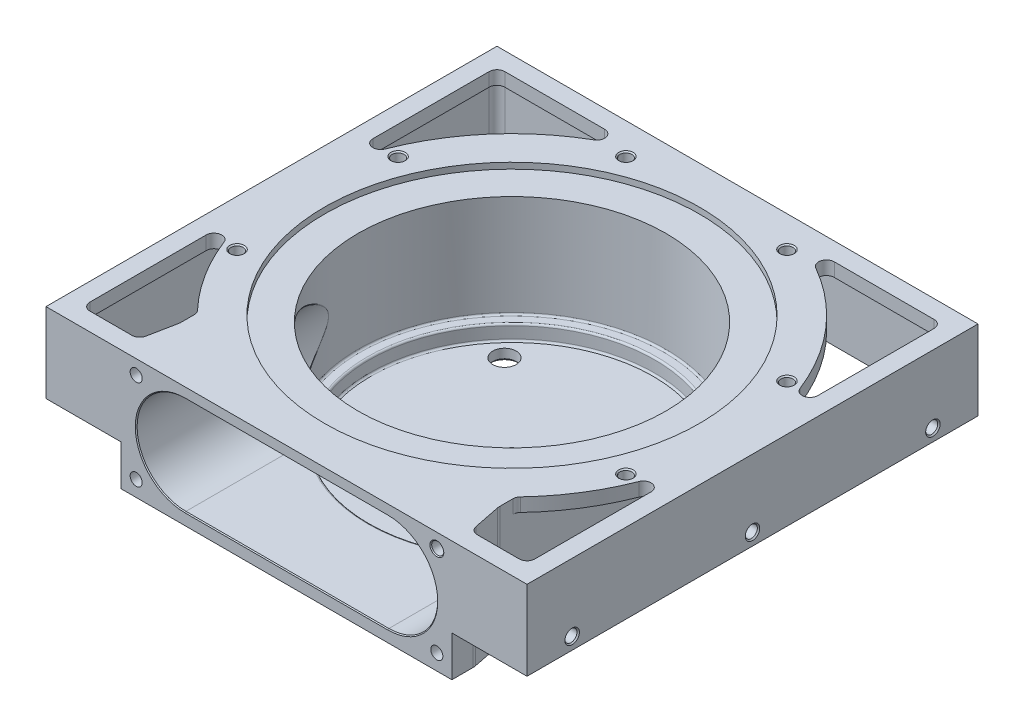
SolidWorks part; units mm, degrees
ref_plane "Front Plane" through (0, 0, 0) normal (0, 0, 1) x (1, 0, 0)
ref_plane "Top Plane" through (0, 0, 0) normal (0, 1, 0) x (1, 0, 0)
ref_plane "Right Plane" through (0, 0, 0) normal (1, 0, 0) x (0, 0, -1)
sketch "Sketch1" plane through (0, 0, 0) normal (0, 1, 0) x (1, 0, 0)
  line L1 (0, 0) -> (203.2, 0)
  line L2 (0, 0) -> (0, 190.5)
  line L3 (0, 190.5) -> (203.2, 190.5)
  line L4 (203.2, 0) -> (203.2, 190.5)
  dimension "D1" = 203.2
  dimension "D2" = 190.5
extrude "block" add sketch "Sketch1" along normal blind 57.15
sketch "Sketch2" plane through (0, 57.15, 0) normal (0, 1, 0) x (1, 0, 0)
  line L0 (101.6, 190.5) -> (101.6, 23.7633) construction
  line L1 (203.2, 190.5) -> (0, 190.5) construction
  line L2 (0, 0) -> (203.2, 0) construction
  circle A0 centre (101.6, 95.25) radius 79.1845
  dimension "D1" = 158.369
  dimension "D2" = 95.25
extrude "tube c bore" cut sketch "Sketch2" against normal blind 2.54
sketch "Sketch9" plane through (0, 54.61, 0) normal (0, 1, 0) x (1, 0, 0)
  line L0 (101.6, 0) -> (101.6, 75.3419) construction
  line L1 (0, 0) -> (203.2, 0) construction
  circle A0 centre (101.6, 95.25) radius 65.024
  dimension "D1" = 130.048
extrude "tube ID cbore" cut sketch "Sketch9" against normal blind 43.18
sketch "Sketch33" plane through (0, 11.43, 0) normal (0, 1, 0) x (1, 0, 0)
  circle A0 centre (101.6, 95.25) radius 60.325
  dimension "D1" = 120.65
extrude "bottom of chamber" cut sketch "Sketch33" against normal blind 6.35
sketch "Sketch5" plane through (0, 0, 0) normal (0, 0, 1) x (1, 0, 0)
  line L0 (101.6, 57.15) -> (101.6, 0) construction
  line L1 (0, 57.15) -> (203.2, 57.15) construction
  line L2 (0, 0) -> (203.2, 0) construction
  line L3 (1.5875, 32.0675) -> (243.4251, 32.0675) construction
  line L4 (58.7375, 52.705) -> (144.4625, 52.705)
  line L5 (144.4625, 11.43) -> (58.7375, 11.43)
  line L10 (166.624, 11.43) -> (36.576, 11.43) construction
  line L11 (101.6, 52.705) -> (101.6, 63.6582) construction
  arc A1 (58.7375, 52.705) -> (58.7375, 11.43) centre (58.7375, 32.0675) ccw
  arc A2 (144.4625, 11.43) -> (144.4625, 52.705) centre (144.4625, 32.0675) ccw
  dimension "D2" = 41.275
  dimension "D4" = 41.275
  dimension "D6" = 85.725
extrude "sensor port" cut sketch "Sketch5" against normal blind 101.6
sketch "Sketch11" plane through (0, 57.15, 0) normal (0, 1, 0) x (1, 0, 0)
  line L0 (101.6, 190.5) -> (101.6, 95.25) construction
  line L1 (101.6, 95.25) -> (101.6, 74.9411) construction
  line L2 (203.2, 190.5) -> (0, 190.5) construction
  line L3 (101.6, 95.25) -> (132.916, 95.25) construction
  line L4 (135.6206, 177.3829) -> (101.6, 95.25) construction
  line L5 (101.6, 95.25) -> (67.5794, 177.3829) construction
  line L6 (36.576, 95.25) -> (101.6, 95.25) construction
  line L7 (183.7329, 129.2706) -> (101.6, 95.25) construction
  circle A0 centre (183.7329, 129.2706) radius 2.5527
  circle A1 centre (183.7329, 61.2294) radius 2.5527
  circle A3 centre (101.6, 95.25) radius 88.9 construction
  circle A5 centre (19.4671, 61.2294) radius 2.5527
  circle A6 centre (19.4671, 129.2706) radius 2.5527
  circle A7 centre (67.5794, 177.3829) radius 2.5527
  circle A8 centre (135.6206, 177.3829) radius 2.5527
  circle A9 centre (101.6, 95.25) radius 65.024 construction
  circle A11 centre (101.6, 95.25) radius 65.024 construction
  circle A12 centre (135.6206, 13.1171) radius 2.5527
  circle A13 centre (67.5794, 13.1171) radius 2.5527
  dimension "D2" = 177.8
  dimension "D3" = 45
  dimension "D5" = 5.1054
  dimension "D6" = 8
  dimension "D4" = 45
  dimension "D1" = 22.5
extrude "tube mounfing holes" cut sketch "Sketch11" against normal blind 19.05
sketch "Sketch12" plane through (0, 0, 0) normal (-1, 0, 0) x (0, 0, 1)
  line L0 (-190.5, 28.575) -> (10.1968, 28.575) construction
  line L1 (-190.5, 57.15) -> (-190.5, 0) construction
  line L2 (-95.25, 57.15) -> (-95.25, -8.8619) construction
  line L3 (-190.5, 57.15) -> (0, 57.15) construction
  circle A0 centre (-95.25, 28.575) radius 2.5527
  circle A1 centre (-171.45, 28.575) radius 2.5527
  circle A2 centre (-19.05, 28.575) radius 2.5527
  dimension "D1" = 5.1054
  dimension "D2" = 5.1054
  dimension "D3" = 5.1054
  dimension "D4" = 76.2
  dimension "D5" = 76.2
extrude "left mt holes" cut sketch "Sketch12" against normal blind 12.7
sketch "Sketch13" plane through (203.2, 0, 0) normal (1, 0, 0) x (0, 0, -1)
  circle A0 centre (19.05, 28.575) radius 2.5527 construction
  circle A1 centre (19.05, 28.575) radius 2.5527
  circle A2 centre (95.25, 28.575) radius 2.5527 construction
  circle A3 centre (95.25, 28.575) radius 2.5527
  circle A4 centre (171.45, 28.575) radius 2.5527 construction
  circle A5 centre (171.45, 28.575) radius 2.5527
extrude "rt mount holes" cut sketch "Sketch13" against normal blind 12.7
sketch "Sketch14" plane through (0, 11.43, 0) normal (0, 1, 0) x (1, 0, 0)
  line L0 (101.6, 95.25) -> (101.6, 150.6135) construction
  line L1 (101.6, 95.25) -> (210.172, 95.25) construction
  circle A0 centre (101.6, 95.25) radius 4.7625
  circle A2 centre (101.6, 95.25) radius 50.8 construction
  dimension "D1" = 9.525
  dimension "D3" = 101.6
extrude "bottom flush port" cut sketch "Sketch14" against normal through all
sketch "Sketch25" plane through (0, 0, 0) normal (0, -1, 0) x (1, 0, 0)
  line L0 (0, 0) -> (0, -203.2)
  line L2 (0, -203.2) -> (88.9, -203.2)
  line L3 (203.2, -203.2) -> (203.2, 0)
  line L4 (203.2, 0) -> (0, 0)
  line L5 (88.9, -203.2) -> (203.2, -203.2)
  circle A0 centre (101.6, -95.25) radius 67.31
  dimension "D1" = 134.62
extrude "bottom weight relif 1" cut sketch "Sketch25" against normal blind 6.35
sketch "Sketch27" plane through (0, 6.35, 0) normal (0, -1, 0) x (1, 0, 0)
  line L0 (31.8758, -10.1539) -> (34.1642, -21.5961)
  line L1 (0, 0) -> (31.75, 0)
  line L2 (0, 0) -> (0, -190.5) construction
  line L3 (0, -190.5) -> (203.2, -190.5) construction
  line L4 (171.45, 0) -> (203.2, 0)
  line L5 (168.91, -95.25) -> (168.91, -22.8663)
  line L6 (0, 0) -> (0, -190.5)
  line L7 (203.2, -190.5) -> (203.2, 0) construction
  line L8 (203.2, -190.5) -> (203.2, 0)
  line L9 (203.2, 0) -> (0, 0) construction
  line L10 (0, -190.5) -> (203.2, -190.5)
  line L11 (31.75, 0) -> (31.75, -8.8837)
  line L13 (171.3242, -10.1539) -> (169.0358, -21.5961)
  line L14 (31.75, -9.525) -> (171.45, -9.525) construction
  line L16 (171.45, -8.8837) -> (171.45, 0)
  line L17 (34.29, -95.25) -> (34.29, -22.8663)
  circle A0 centre (101.6, -95.25) radius 67.31 construction
  arc A1 (74.7084, -156.9548) -> (168.91, -95.25) centre (101.6, -95.25) ccw
  arc A2 (34.29, -95.25) -> (74.7084, -156.9548) centre (101.6, -95.25) ccw
  circle A3 centre (101.6, -95.25) radius 67.31 construction
  arc A4 (171.45, -8.8837) -> (171.3242, -10.1539) centre (164.973, -8.8837) cw
  circle A5 centre (101.6, -95.25) radius 67.31 construction
  arc A6 (168.91, -22.8663) -> (169.0358, -21.5961) centre (175.387, -22.8663) cw
  arc A7 (31.75, -8.8837) -> (31.8758, -10.1539) centre (38.227, -8.8837) ccw
  arc A8 (34.1642, -21.5961) -> (34.29, -22.8663) centre (27.813, -22.8663) cw
  point P15 (67.138, -37.4313)
  point P34 (168.91, -22.225)
  point P40 (34.29, -22.225)
  dimension "D1" = 9.525
  dimension "D2" = 12.7
  dimension "D4" = 6.477
  dimension "D3" = 12.7
  dimension "D5" = 139.7
  dimension "D6" = 9.525
  dimension "D7" = 31.75
  dimension "D8" = 31.75
extrude "bot weight relif 2" cut sketch "Sketch27" against normal blind 17.145
chamfer "1/4-20 holes" distance 0.508 angle 45 12 edges at (203.2, 28.575, -21.6027) (203.2, 28.575, -97.8027) (203.2, 28.575, -174.0027) (19.4671, 57.15, -58.6767) (183.7329, 57.15, -58.6767) (183.7329, 57.15, -126.7179) (135.6206, 57.15, -174.8302) (67.5794, 57.15, -174.8302) (19.4671, 57.15, -126.7179) (0, 28.575, -168.8973) (0, 28.575, -16.4973) (0, 28.575, -92.6973)
chamfer "under side" distance 2.54 angle 45 1 edges at (101.6, 0, -162.56)
sketch "Sketch28" plane through (0, 0, 0) normal (0, 0, 1) x (1, 0, 0)
  line L0 (58.7375, 11.43) -> (144.4625, 11.43) construction
  line L1 (38.1, 51.1175) -> (165.1, 51.1175) construction
  line L2 (38.1, 51.1175) -> (38.1, 13.0175) construction
  line L3 (38.1, 13.0175) -> (165.1, 13.0175) construction
  line L4 (165.1, 51.1175) -> (165.1, 13.0175) construction
  line L5 (101.6, 11.43) -> (101.6, 21.1068) construction
  line L7 (101.6, 13.0175) -> (101.6, -8.3814) construction
  line L8 (58.7375, 32.0675) -> (107.9365, 32.0675) construction
  line L9 (165.1, 32.0675) -> (149.6768, 32.0675) construction
  circle A0 centre (38.1, 51.1175) radius 2.5527
  circle A1 centre (38.1, 13.0175) radius 2.5527
  circle A2 centre (165.1, 51.1175) radius 2.5527
  circle A3 centre (165.1, 13.0175) radius 2.5527
  dimension "D1" = 5.1054
  dimension "D2" = 5.1054
  dimension "D3" = 5.1054
  dimension "D4" = 5.1054
  dimension "D5" = 38.1
  dimension "D6" = 127
extrude "sensor mount holes" cut sketch "Sketch28" against normal blind 19.05
chamfer "sensor hole" distance 0.381 angle 45 11 edges at (101.6, 52.705, 0) (38.1, 32.0675, 0) (101.6, 11.43, 0) (165.1, 32.0675, 0) (165.0949, 31.6093, -81.2316) (38.1051, 32.5257, -81.2316) (101.6, 52.705, -30.226) (167.6527, 51.1175, 0) (167.6527, 13.0175, -19.05) (40.6527, 13.0175, -19.05) (40.6527, 51.1175, -19.05)
sketch "Sketch30" plane through (0, 23.495, 0) normal (0, -1, 0) x (1, 0, 0)
  line L0 (34.29, -95.25) -> (34.29, -22.8663) construction
  line L1 (34.29, -95.25) -> (34.29, -22.8663)
  line L3 (168.91, -22.8663) -> (168.91, -95.25) construction
  line L4 (168.91, -22.8663) -> (168.91, -95.25)
  line L5 (0, 0) -> (0, -190.5) construction
  line L6 (8.0645, -4.7625) -> (28.448, -4.7625)
  line L7 (4.7625, -8.0645) -> (4.7625, -182.4355)
  line L8 (8.0645, -185.7375) -> (195.1355, -185.7375)
  line L9 (198.4375, -8.0645) -> (198.4375, -182.4355)
  line L10 (203.2, 0) -> (171.45, 0) construction
  line L11 (203.2, -190.5) -> (203.2, 0) construction
  line L12 (0, -190.5) -> (203.2, -190.5) construction
  line L14 (171.3242, -10.1539) -> (169.0358, -21.5961) construction
  line L15 (171.45, 0) -> (171.45, -8.8837) construction
  line L16 (171.3242, -10.1539) -> (169.0358, -21.5961)
  line L17 (171.45, -8.0645) -> (171.45, -8.8837)
  line L18 (34.1642, -21.5961) -> (31.8758, -10.1539) construction
  line L19 (31.75, -8.8837) -> (31.75, 0) construction
  line L20 (34.1642, -21.5961) -> (31.8758, -10.1539)
  line L21 (31.75, -8.8837) -> (31.75, -8.0645)
  line L22 (174.752, -4.7625) -> (195.1355, -4.7625)
  arc A0 (169.0358, -21.5961) -> (168.91, -22.8663) centre (175.387, -22.8663) ccw construction
  circle A1 centre (101.6, -95.25) radius 67.31 construction
  arc A2 (34.29, -95.25) -> (168.91, -95.25) centre (101.6, -95.25) ccw
  arc A3 (171.3242, -10.1539) -> (171.45, -8.8837) centre (164.973, -8.8837) ccw construction
  arc A4 (169.0358, -21.5961) -> (168.91, -22.8663) centre (175.387, -22.8663) ccw
  arc A5 (171.3242, -10.1539) -> (171.45, -8.8837) centre (164.973, -8.8837) ccw
  arc A6 (34.29, -22.8663) -> (34.1642, -21.5961) centre (27.813, -22.8663) ccw construction
  arc A7 (31.75, -8.8837) -> (31.8758, -10.1539) centre (38.227, -8.8837) ccw construction
  arc A8 (34.29, -22.8663) -> (34.1642, -21.5961) centre (27.813, -22.8663) ccw
  arc A9 (31.75, -8.8837) -> (31.8758, -10.1539) centre (38.227, -8.8837) ccw
  arc A10 (174.752, -4.7625) -> (171.45, -8.0645) centre (174.752, -8.0645) ccw
  arc A11 (195.1355, -4.7625) -> (198.4375, -8.0645) centre (195.1355, -8.0645) cw
  arc A12 (198.4375, -182.4355) -> (195.1355, -185.7375) centre (195.1355, -182.4355) cw
  arc A13 (4.7625, -182.4355) -> (8.0645, -185.7375) centre (8.0645, -182.4355) ccw
  arc A14 (4.7625, -8.0645) -> (8.0645, -4.7625) centre (8.0645, -8.0645) cw
  arc A15 (28.448, -4.7625) -> (31.75, -8.0645) centre (28.448, -8.0645) cw
  point P34 (171.45, -4.7625)
  dimension "D1" = 3.302
  dimension "D3" = 4.7625
  dimension "D4" = 4.7625
  dimension "D5" = 4.7625
  dimension "D6" = 4.7625
extrude "under side weight relief 2" cut sketch "Sketch30" against normal blind 27.94
sketch "Sketch31" plane through (0, 57.15, 0) normal (0, 1, 0) x (1, 0, 0)
  line L0 (203.2, 190.5) -> (0, 190.5) construction
  line L1 (10.922, 182.88) -> (53.0966, 182.88)
  line L2 (7.62, 179.578) -> (7.62, 130.4819)
  line L3 (10.922, 7.62) -> (28.662, 7.62)
  line L4 (195.58, 179.578) -> (195.58, 130.4819)
  line L5 (0, 190.5) -> (0, 0) construction
  line L6 (0, 0) -> (203.2, 0) construction
  line L7 (203.2, 0) -> (203.2, 190.5) construction
  line L8 (150.1034, 182.88) -> (192.278, 182.88)
  line L9 (174.538, 7.62) -> (192.278, 7.62)
  line L10 (7.62, 60.0181) -> (7.62, 10.922)
  line L11 (195.58, 60.0181) -> (195.58, 10.922)
  line L12 (34.29, 28.3341) -> (34.29, 22.8663)
  line L13 (34.29, 95.25) -> (34.29, 22.8663) construction
  line L14 (34.1642, 21.5961) -> (31.8758, 10.1539) construction
  line L15 (34.1642, 21.5961) -> (31.8999, 10.2744)
  line L16 (171.3242, 10.1539) -> (169.0358, 21.5961) construction
  line L17 (168.91, 22.8663) -> (168.91, 95.25) construction
  line L18 (171.3001, 10.2744) -> (169.0358, 21.5961)
  line L19 (168.91, 22.8663) -> (168.91, 28.3341)
  arc A0 (54.743, 176.7157) -> (13.9998, 129.2861) centre (101.6, 95.25) ccw
  arc A1 (169.8152, 30.6054) -> (189.2002, 61.2139) centre (101.6, 95.25) ccw
  arc A2 (13.9998, 61.2139) -> (33.3848, 30.6054) centre (101.6, 95.25) ccw
  arc A3 (189.2002, 129.2861) -> (148.457, 176.7157) centre (101.6, 95.25) ccw
  arc A4 (192.278, 182.88) -> (195.58, 179.578) centre (192.278, 179.578) cw
  arc A5 (195.58, 130.4819) -> (189.2002, 129.2861) centre (192.278, 130.4819) cw
  arc A6 (148.457, 176.7157) -> (150.1034, 182.88) centre (150.1034, 179.578) cw
  arc A7 (192.278, 7.62) -> (195.58, 10.922) centre (192.278, 10.922) ccw
  arc A8 (195.58, 60.0181) -> (189.2002, 61.2139) centre (192.278, 60.0181) ccw
  arc A9 (34.29, 22.8663) -> (34.1642, 21.5961) centre (27.813, 22.8663) cw
  arc A10 (7.62, 10.922) -> (10.922, 7.62) centre (10.922, 10.922) ccw
  arc A11 (28.662, 7.62) -> (31.8999, 10.2744) centre (28.662, 10.922) ccw
  arc A12 (13.9998, 61.2139) -> (7.62, 60.0181) centre (10.922, 60.0181) ccw
  arc A13 (7.62, 130.4819) -> (13.9998, 129.2861) centre (10.922, 130.4819) ccw
  arc A14 (10.922, 182.88) -> (7.62, 179.578) centre (10.922, 179.578) ccw
  arc A15 (54.743, 176.7157) -> (53.0966, 182.88) centre (53.0966, 179.578) ccw
  arc A16 (34.29, 28.3341) -> (33.3848, 30.6054) centre (30.988, 28.3341) ccw
  arc A17 (168.91, 22.8663) -> (169.0358, 21.5961) centre (175.387, 22.8663) ccw construction
  arc A18 (168.91, 22.8663) -> (169.0358, 21.5961) centre (175.387, 22.8663) ccw
  arc A19 (169.8152, 30.6054) -> (168.91, 28.3341) centre (172.212, 28.3341) ccw
  arc A20 (171.3001, 10.2744) -> (174.538, 7.62) centre (174.538, 10.922) ccw
  point P26 (195.58, 95.25)
  point P29 (135.5591, 182.88)
  point P36 (135.5591, 7.62)
  point P43 (7.62, 95.25)
  point P59 (34.29, 29.6634)
  dimension "D5" = 93.98
  dimension "D6" = 3.302
  dimension "D7" = 3.302
  dimension "D8" = 3.302
  dimension "D9" = 3.302
  dimension "D10" = 3.302
  dimension "D1" = 7.62
  dimension "D2" = 7.62
  dimension "D3" = 7.62
  dimension "D4" = 7.62
extrude "thru cuts" cut sketch "Sketch31" against normal through all
fillet "underside" radius 0.762 3 edges at (101.6, 11.43, -34.925) (101.6, 5.08, -34.925)
hole_wizard "7/16-20 Tapped Hole1" positions "Sketch36" profile "Sketch35" tap size "7/16-20" standard "ANSI Inch"
sketch "Sketch36" plane through (0, 0, 0) normal (0, -1, 0) x (-1, 0, 0)
  line L0 (-101.6, 95.25) -> (-101.6, 179.4508) construction
  line L3 (-34.3921, 130.175) -> (-231.1974, 130.175) construction
  point P10 (-63.5, 130.175)
  point P12 (-139.7, 130.175)
  dimension "D1" = 34.925
  dimension "D2" = 38.1
  dimension "D3" = 38.1
sketch "Sketch35" plane through (63.5, 0, -130.175) normal (1, 0, 0) x (0, 0, -1)
  line L0 (0, 0) -> (0, 31.5556)
  line L1 (0, 31.5556) -> (4.9606, 28.575)
  line L2 (4.9606, 28.575) -> (4.9606, 1.2306)
  line L3 (4.9606, 1.2306) -> (6.1913, 0)
  line L5 (6.1913, 0) -> (0, 0)
  line L6 (-4.9606, 1.2306) -> (-6.1913, 0) construction
  line L10 (0, 31.5556) -> (-4.9606, 28.575) construction
  line L11 (0, -6.35) -> (0, 107.95) construction
  dimension "Tap Drill Dia." = 9.9212
  dimension "Tap Drill Depth" = 28.575
  dimension "Near C'Sink Dia." = 12.3825
  dimension "Near C'Sink Angle" = 90
  dimension "Drill Angle" = 118
chamfer "Chamfer1" distance 0.381 angle 45 2 edges at (101.6, 0, -90.4875) (101.6, 5.08, -90.4875)
